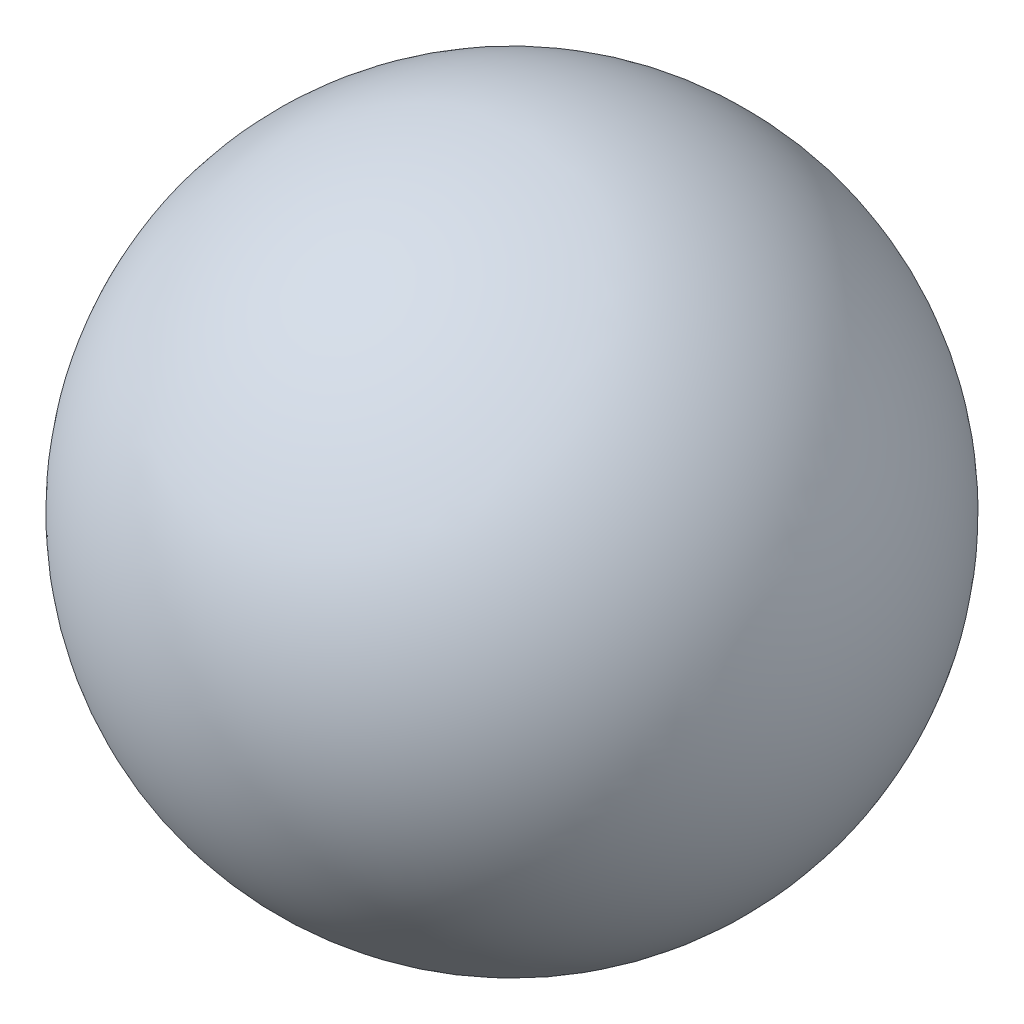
SolidWorks part; units mm, degrees
ref_plane "Face" through (0, 0, 0) normal (0, 0, 1) x (1, 0, 0)
ref_plane "Dessus" through (0, 0, 0) normal (0, 1, 0) x (1, 0, 0)
ref_plane "Droite" through (0, 0, 0) normal (1, 0, 0) x (0, 0, -1)
sketch "Esquisse1" plane through (0, 0, 0) normal (0, 0, 1) x (1, 0, 0)
  line L0 (-31.6677, 0) -> (38.3161, 0) construction
  line L1 (-2, 0) -> (2, 0)
  arc A0 (2, 0) -> (-2, 0) centre (0, 0) ccw
  dimension "D1" = 4
revolve "Révolution1" add sketch "Esquisse1" angle 360 about L0
